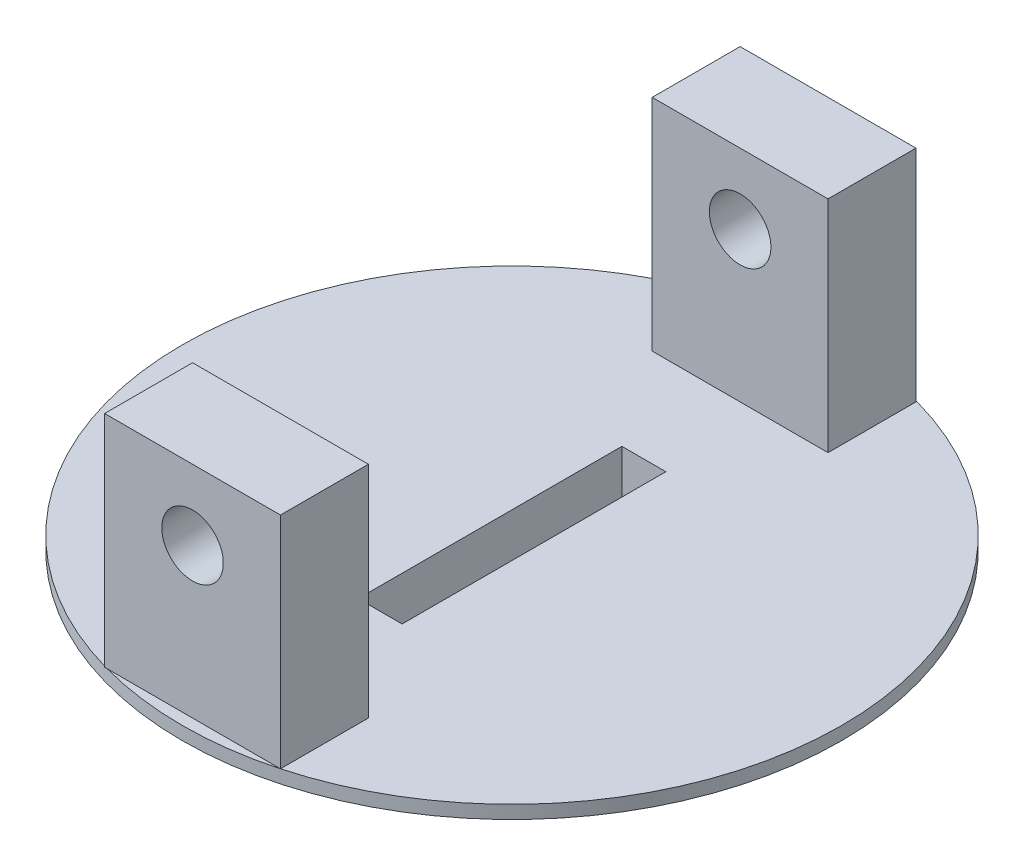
SolidWorks part; units mm, degrees
ref_plane "Plan de face" through (0, 0, 0) normal (0, 0, 1) x (1, 0, 0)
ref_plane "Plan de dessus" through (0, 0, 0) normal (0, 1, 0) x (1, 0, 0)
ref_plane "Plan de droite" through (0, 0, 0) normal (1, 0, 0) x (0, 0, -1)
sketch "Esquisse1" plane through (0, 0, 0) normal (0, 1, 0) x (1, 0, 0)
  circle A0 centre (0, 0) radius 37.5
  dimension "D1" = 75
extrude "Boss.-Extru.1" add sketch "Esquisse1" along normal blind 1.5
sketch "Esquisse2" plane through (0, 1.5, 0) normal (0, 1, 0) x (1, 0, 0)
  circle A0 centre (0, 0) radius 17.5
  dimension "D1" = 35
extrude "Boss.-Extru.2" add sketch "Esquisse2" against normal blind 8
sketch "Esquisse4" plane through (0, 1.5, 0) normal (0, 1, 0) x (1, 0, 0)
  line L1 (9.8481, -36.1838) -> (-10.1519, -36.1838)
  line L2 (9.8481, -36.1838) -> (9.8481, 36.0997)
  line L3 (9.8481, 36.0997) -> (-10.1519, 36.0997)
  line L4 (-10.1519, -36.1838) -> (-10.1519, 36.0997)
  circle A0 centre (0, 0) radius 37.5 construction
  dimension "D1" = 20
  dimension "D2" = 72.2835
extrude "Boss.-Extru.5" add sketch "Esquisse4" along normal blind 25
sketch "Esquisse8" plane through (0, 0, -36.0997) normal (0, 0, -1) x (-1, 0, 0)
sketch "Esquisse10" plane through (0, 1.5, 0) normal (0, 1, 0) x (1, 0, 0)
  line L0 (37.5, 0) -> (-37.5, 0) construction
  arc A0 (9.8481, -36.1838) -> (-10.1519, 36.0997) centre (0, 0) ccw construction
  arc A1 (-10.1519, 36.0997) -> (-10.1519, -36.0997) centre (0, 0) ccw construction
sketch "Esquisse11" plane through (9.8481, 0, 0) normal (1, 0, 0) x (0, 0, -1)
  line L0 (-36.1838, 1.5) -> (36.0997, 1.5) construction
  line L1 (-26.1838, 1.5) -> (26.0997, 1.5)
  line L2 (-26.1838, 1.5) -> (-26.1838, 26.5)
  line L3 (-26.1838, 26.5) -> (26.0997, 26.5)
  line L4 (26.0997, 1.5) -> (26.0997, 26.5)
  line L5 (-36.1838, 26.5) -> (36.0997, 26.5) construction
  dimension "D1" = 10
  dimension "D2" = 10
extrude "Enlèv. mat.-Extru.5" cut sketch "Esquisse11" against normal blind 25
sketch "Esquisse12" plane through (0, 0, -36.0997) normal (0, 0, -1) x (-1, 0, 0)
  line L0 (-9.8481, 26.5) -> (-9.8481, 1.5) construction
  line L2 (-9.8481, 1.5) -> (10.1519, 1.5) construction
  circle A0 centre (0.1519, 18.5) radius 3.5
  dimension "D1" = 7
  dimension "D2" = 10
  dimension "D3" = 17
extrude "Enlèv. mat.-Extru.8" cut sketch "Esquisse12" against normal through all
sketch "Esquisse13" plane through (0, 1.5, 0) normal (0, 1, 0) x (1, 0, 0)
  line L0 (37.5, 0) -> (-37.5, 0) construction
  line L1 (2.5, 15) -> (-2.5, 15)
  line L2 (2.5, 15) -> (2.5, -15)
  line L3 (2.5, -15) -> (-2.5, -15)
  line L4 (-2.5, 15) -> (-2.5, -15)
  point P6 (0, 0)
  point P7 (2.5, 0)
  point P8 (0, 15)
  dimension "D1" = 30
  dimension "D2" = 5
  dimension "D3" = 0
  dimension "D4" = 0
extrude "Enlèv. mat.-Extru.9" cut sketch "Esquisse13" against normal blind 12
